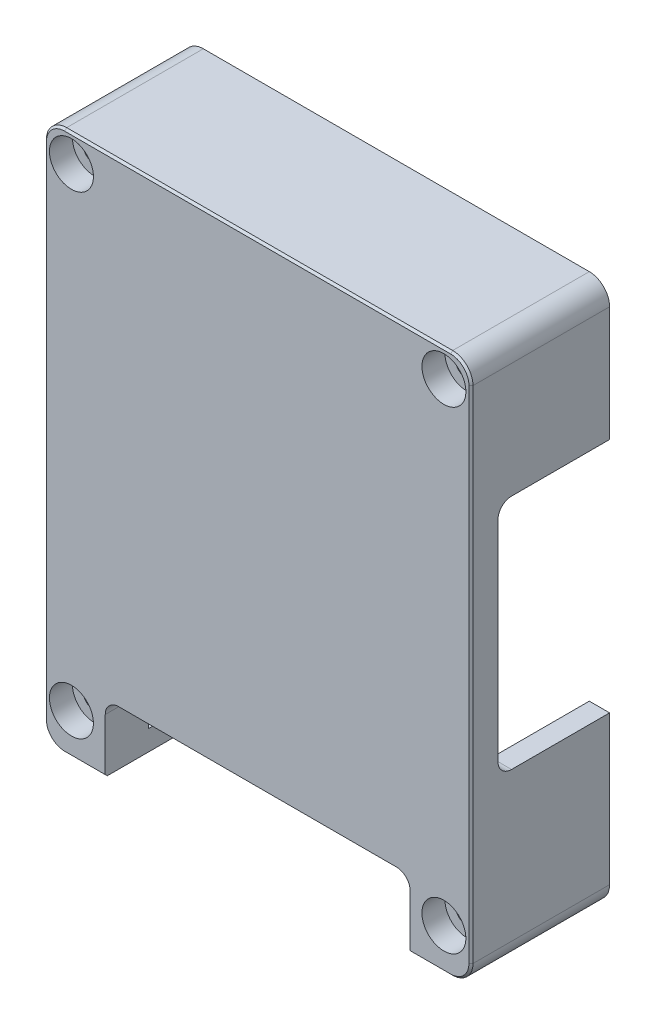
SolidWorks part; units mm, degrees
ref_plane "Ebene vorne" through (0, 0, 0) normal (0, 0, 1) x (1, 0, 0)
ref_plane "Ebene oben" through (0, 0, 0) normal (0, 1, 0) x (1, 0, 0)
ref_plane "Ebene rechts" through (0, 0, 0) normal (1, 0, 0) x (0, 0, -1)
sketch "Skizze1" plane through (0, 0, 0) normal (0, 0, 1) x (1, 0, 0)
  line L1 (-31.5375, -40) -> (31.5375, -40)
  line L2 (-31.5375, -40) -> (-31.5375, 40)
  line L3 (-31.5375, 40) -> (31.5375, 40)
  line L4 (31.5375, -40) -> (31.5375, 40)
  line L5 (-31.5375, -40) -> (31.5375, 40) construction
  line L6 (-31.5375, 40) -> (31.5375, -40) construction
  point P0 (0, 0)
  dimension "D1" = 80
  dimension "D2" = 63.075
extrude "Aufsatz-Linear austragen1" add sketch "Skizze1" along normal blind 20.5
hole_wizard "Stirnsenkung für M3 Zylinderschraube mit Innensechskant1" positions "Skizze3" profile "Skizze4" counterbore size "M3" standard "DIN"
sketch "Skizze3" plane through (0, 0, 20.5) normal (0, 0, -1) x (-1, 0, 0)
  line L0 (-31.5375, -40) -> (-31.5375, 40) construction
  line L1 (-31.5375, 40) -> (31.5375, 40) construction
  line L2 (31.5375, 40) -> (31.5375, -40) construction
  point P0 (-27.5375, 36)
  point P2 (27.5375, 36)
  point P4 (27.5375, -34)
  point P6 (-27.5375, -34)
  dimension "D1" = 4
  dimension "D2" = 4
  dimension "D3" = 70
  dimension "D4" = 4
sketch "Skizze4" plane through (27.5375, 36, 20.5) normal (1, 0, 0) x (0, -1, 0)
  line L0 (0, 0) -> (0, 20.5)
  line L1 (0, 20.5) -> (1.7, 20.5)
  line L3 (1.7, 20.5) -> (1.7, 3.4)
  line L4 (1.7, 3.4) -> (3.25, 3.4)
  line L5 (3.25, 3.4) -> (3.25, 0)
  line L7 (3.25, 0) -> (0, 0)
  line L11 (0, -6.35) -> (0, 107.95) construction
  dimension "Bohrerdurchmesser" = 3.4
  dimension "Bohrungstiefe" = 20.5
  dimension "Senkdurchmesser2" = 6.5
  dimension "Senktiefe2" = 3.4
shell "Wandung1" thickness 3
sketch "Skizze7" plane through (31.5375, 0, 0) normal (1, 0, 0) x (0, 0, -1)
  line L0 (0, -40) -> (0, 40) construction
  line L1 (0, 20) -> (-16.5, 20)
  line L2 (0, 20) -> (0, -15)
  line L3 (0, -15) -> (-16.5, -15)
  line L4 (-16.5, 20) -> (-16.5, -15)
  line L5 (-20.5, -40) -> (-20.5, 40) construction
  line L6 (-20.5, 40) -> (0, 40) construction
  line L7 (-20.5, -40) -> (0, -40) construction
  dimension "D1" = 4
  dimension "D2" = 20
  dimension "D3" = 25
extrude "Schnitt-Linear austragen2" cut sketch "Skizze7" against normal through all
sketch "Skizze8" plane through (0, -40, 0) normal (0, -1, 0) x (1, 0, 0)
  line L0 (-31.5375, 0) -> (31.5375, 0) construction
  line L1 (-22.5375, 0) -> (22.5375, 0)
  line L2 (-22.5375, 0) -> (-22.5375, 20.5)
  line L3 (-22.5375, 20.5) -> (22.5375, 20.5)
  line L4 (22.5375, 0) -> (22.5375, 20.5)
  line L5 (31.5375, 20.5) -> (31.5375, 0) construction
  line L8 (-31.5375, 20.5) -> (31.5375, 20.5) construction
  line L9 (-31.5375, 20.5) -> (-31.5375, 0) construction
  dimension "D1" = 9
  dimension "D2" = 9
extrude "Schnitt-Linear austragen3" cut sketch "Skizze8" against normal blind 10
fillet "Verrundung1" radius 3 4 edges at (-31.5375, -40, 10.25) (31.5375, -40, 10.25) (-31.5375, 40, 10.25) (31.5375, 40, 10.25)
fillet "Verrundung2" radius 2 6 edges at (-30.0375, 20, 16.5) (-30.0375, -15, 16.5) (30.0375, -15, 16.5) (30.0375, 20, 16.5) (22.5375, -30, 19) (-22.5375, -30, 19)
chamfer "Fase1" distance 0.3 angle 45 9 edges at (-25.5375, -40, 20.5) (25.5375, -40, 20.5) (30.6588, -39.1213, 20.5) (-30.6588, -39.1213, 20.5) (31.5375, 0, 20.5) (-31.5375, 0, 20.5) (30.6588, 39.1213, 20.5) (-30.6588, 39.1213, 20.5) (0, 40, 20.5)
